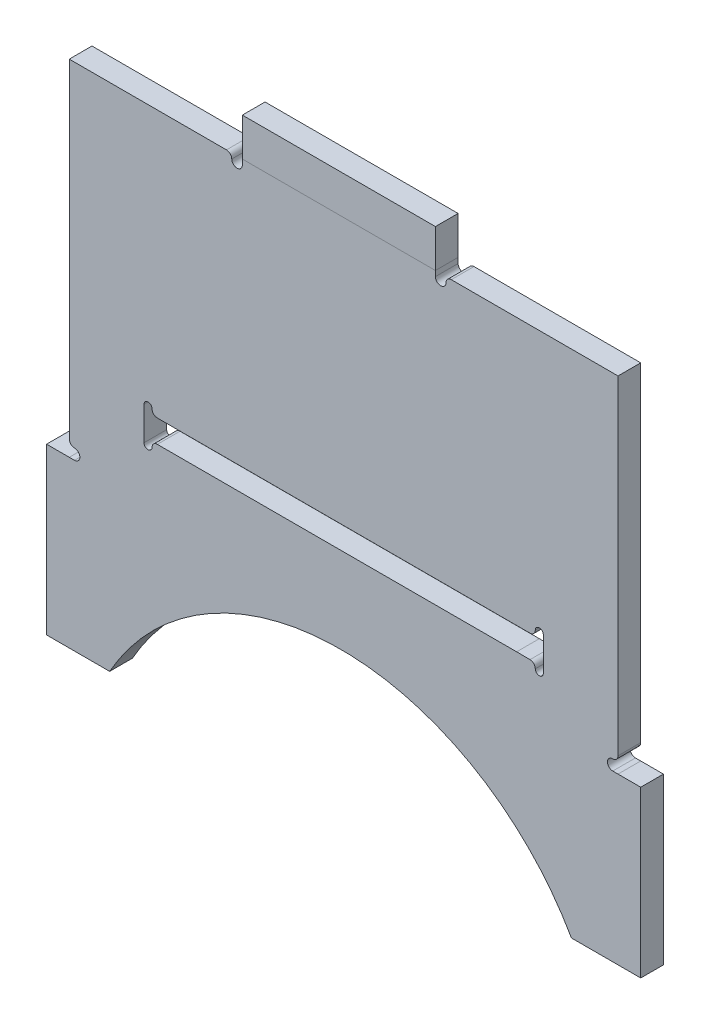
SolidWorks part; units mm, degrees
ref_plane "Front Plane" through (0, 0, 0) normal (0, 0, 1) x (1, 0, 0)
ref_plane "Top Plane" through (0, 0, 0) normal (0, 1, 0) x (1, 0, 0)
ref_plane "Right Plane" through (0, 0, 0) normal (1, 0, 0) x (0, 0, -1)
sketch "Sketch1" plane through (0, 0, 0) normal (0, 0, 1) x (1, 0, 0)
  line L0 (17, 123.73) -> (17, 381.93)
  line L1 (0, 0) -> (444.91, 0)
  line L2 (0, 0) -> (0, 123.73)
  line L3 (17, 381.93) -> (427.91, 381.93)
  line L4 (427.91, 123.73) -> (427.91, 381.93)
  line L5 (0, 123.73) -> (17, 123.73)
  line L6 (0, 123.73) -> (0, 0)
  line L7 (0, 0) -> (17, 0)
  line L8 (222.455, 381.93) -> (222.455, 516.2609) construction
  line L9 (444.91, 0) -> (444.91, 123.73)
  line L10 (444.91, 123.73) -> (427.91, 123.73)
  line L11 (17, 252.83) -> (427.91, 252.83) construction
  line L12 (0, 0) -> (47.2402, 0)
  line L13 (393.0143, 0) -> (444.91, 0)
  line L14 (222.455, 0) -> (222.455, 90.9825) construction
  arc A0 (47.2402, 0) -> (393.0143, 0) centre (220.1273, -97.8115) cw
  line B0 (20.9571, 123.7432) -> (17, 123.73)
  line B1 (17, 123.73) -> (17, 135.6144)
  arc B2 (17, 135.6144) -> (20.9571, 131.6573) centre (20.9571, 135.6144) ccw
  arc B3 (20.9571, 123.7432) -> (20.9571, 131.6573) centre (20.9571, 127.7003) ccw
  line B4 (423.9529, 123.7432) -> (427.91, 123.73)
  line B5 (427.91, 123.73) -> (427.91, 135.6144)
  arc B6 (427.91, 135.6144) -> (423.9529, 131.6573) centre (423.9529, 135.6144) cw
  arc B7 (423.9529, 123.7432) -> (423.9529, 131.6573) centre (423.9529, 127.7003) cw
  dimension "D1" = 410.91
  dimension "D2" = 165.08
  dimension "D3" = 123.73
  dimension "D4" = 17
  dimension "D5" = 55.96
sketch_block_instance "female block-1"
sketch_block "female block"
sketch_block_instance "Block-groove to cut the edges-1"
sketch_block "Block-groove to cut the edges"
sketch_block_instance "Block-groove to cut the edges-4"
extrude "Boss-Extrude1" add sketch "Sketch1" along normal blind 17
sketch "Sketch2" plane through (0, 0, 17) normal (0, 0, 1) x (1, 0, 0)
  line L0 (17, 381.93) -> (427.91, 381.93) construction
  line L1 (146.6, 381.93) -> (291.16, 381.93)
  line L2 (146.6, 381.93) -> (146.6, 410.4348)
  line L3 (146.6, 410.4348) -> (291.16, 410.4348)
  line L4 (291.16, 381.93) -> (291.16, 410.4348)
  line L5 (17, 135.6144) -> (17, 381.93) construction
  point P6 (146.6, 396.1824)
  dimension "D1" = 129.6
  dimension "D2" = 144.56
extrude "Boss-Extrude2" add sketch "Sketch2" against normal blind 17 separate body
sketch "Sketch3" plane through (0, 0, 17) normal (0, 0, 1) x (1, 0, 0)
  line L0 (17, 381.93) -> (427.91, 381.93) construction
  line L1 (291.1732, 377.9729) -> (291.16, 381.93)
  line L2 (146.6, 381.93) -> (291.16, 381.93) construction
  line L3 (291.16, 381.93) -> (303.0444, 381.93)
  line L4 (218.88, 410.4348) -> (218.88, 416.3708) construction
  line L5 (291.16, 410.4348) -> (146.6, 410.4348) construction
  line L6 (146.6, 381.93) -> (134.7156, 381.93)
  line L7 (146.5868, 377.9729) -> (146.6, 381.93)
  arc A0 (303.0444, 381.93) -> (299.0873, 377.9729) centre (303.0444, 377.9729) ccw
  arc A1 (291.1732, 377.9729) -> (299.0873, 377.9729) centre (295.1303, 377.9729) ccw
  arc A2 (146.5868, 377.9729) -> (138.6727, 377.9729) centre (142.6297, 377.9729) cw
  arc A3 (134.7156, 381.93) -> (138.6727, 377.9729) centre (134.7156, 377.9729) cw
extrude "Cut-Extrude1" cut sketch "Sketch3" against normal blind 17
equation "\"EndMill_HalfDiameter\"=3"
equation "\"D1@Block3\"=\"EndMill_HalfDiameter\""
equation "\"D2@Block3\"=\"EndMill_HalfDiameter\""
equation "\"D3@Block3\"=\"EndMill_HalfDiameter\""
equation "\"D4@Block3\"=\"EndMill_HalfDiameter\""
equation "\"D9@Block3\"=\"EndMill_HalfDiameter\""
equation "\"D10@Block3\"=\"EndMill_HalfDiameter\""
equation "\"D11@Block3\"=\"EndMill_HalfDiameter\""
equation "\"D12@Block3\"=\"EndMill_HalfDiameter\""
equation "\"WoodThickness\" = 17mm"
equation "\"D1@Boss-Extrude1\"=\"WoodThickness\""
equation "\"InnerLengthControl\"=10"
equation "\"D5@Block3\"=\"InnerLengthControl\""
equation "\"D1@female block\"=\"EndMill_HalfDiameter\""
equation "\"D2@female block\"=\"EndMill_HalfDiameter\""
equation "\"D3@female block\"=\"EndMill_HalfDiameter\""
equation "\"D4@female block\"=\"EndMill_HalfDiameter\""
equation "\"D5@female block\"=\"InnerLengthControl\""
